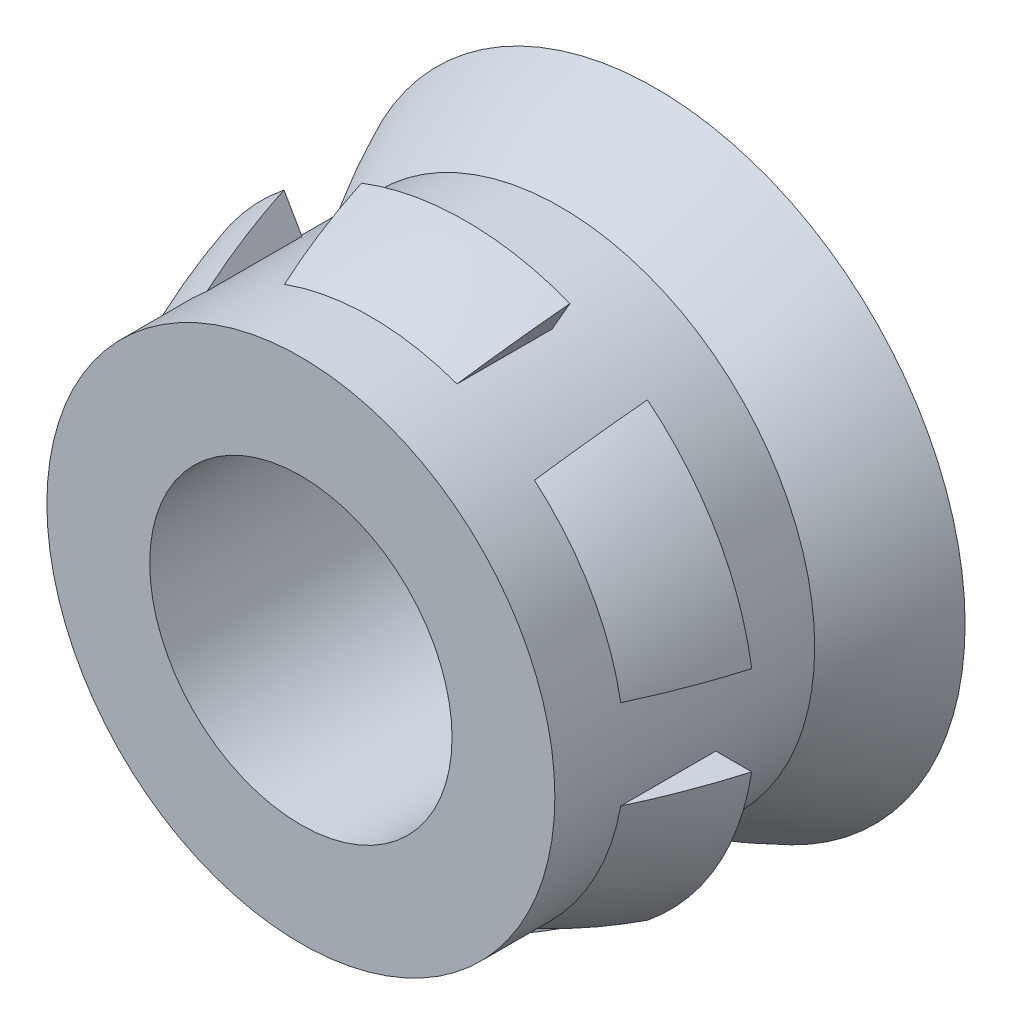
SolidWorks part; units mm, degrees
other "<insert 6-32(632S7-8)>-<CirPattern1>"
ref_plane "Front" through (0, 0, 0) normal (0, 0, 1) x (1, 0, 0)
ref_plane "Top" through (0, 0, 0) normal (0, 1, 0) x (1, 0, 0)
ref_plane "Right" through (0, 0, 0) normal (1, 0, 0) x (0, 0, -1)
inserted part "insert 6-32(632S7-8)"
sketch "Sketch1" plane through (0, 0, -12.8276) normal (0, 0, 1) x (1, 0, 0)
  circle A0 centre (9.2304, 0) radius 3.217
extrude "Cut-Extrude1" cut sketch "Sketch1" against normal blind 3.175
